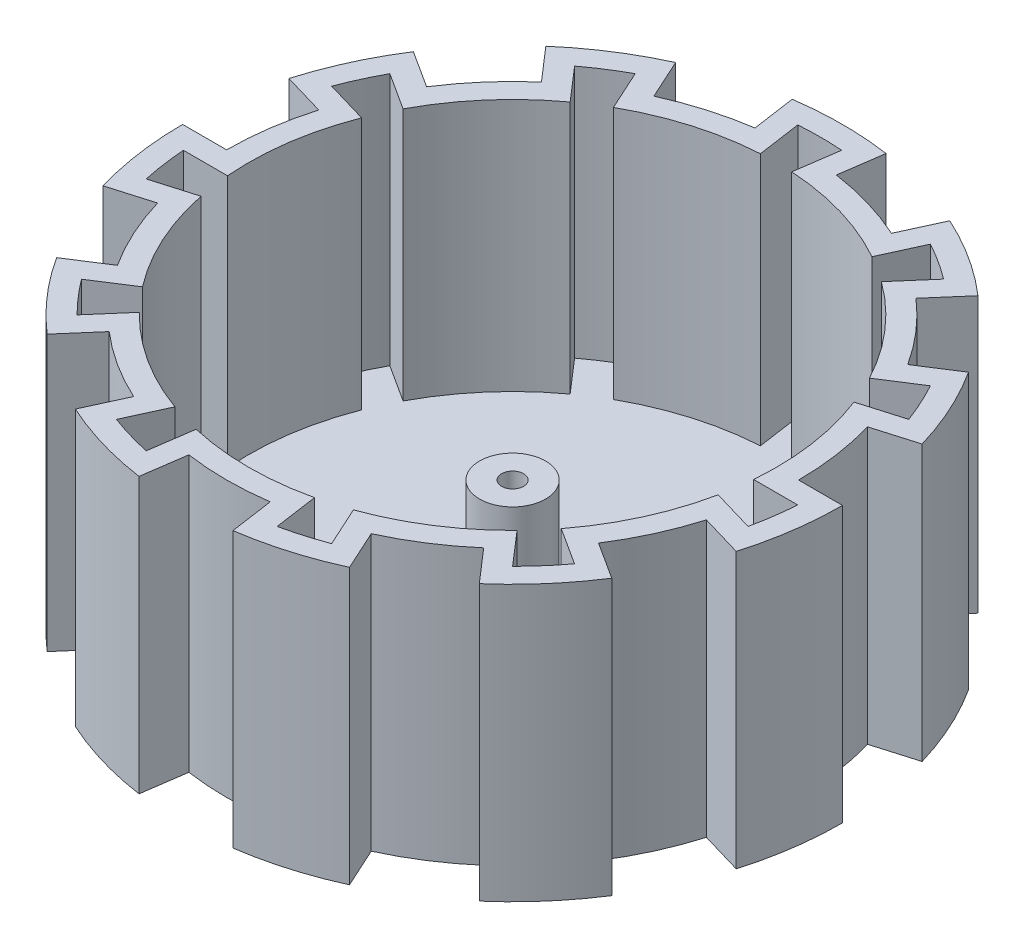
SolidWorks part; units mm, degrees
ref_plane "Front Plane" through (0, 0, 0) normal (0, 0, 1) x (1, 0, 0)
ref_plane "Top Plane" through (0, 0, 0) normal (0, 1, 0) x (1, 0, 0)
ref_plane "Right Plane" through (0, 0, 0) normal (1, 0, 0) x (0, 0, -1)
sketch "Sketch1" plane through (0, 0, 0) normal (0, 1, 0) x (1, 0, 0)
  line L0 (-38.1, 0) -> (-33.02, 0)
  line L1 (-32.0518, 20.5984) -> (-27.7782, 17.852)
  line L2 (-15.8273, 34.657) -> (-13.717, 30.036)
  line L3 (5.4222, 37.7122) -> (4.6992, 32.6839)
  line L4 (24.9502, 28.7941) -> (21.6235, 24.9549)
  line L5 (36.5567, 10.734) -> (31.6825, 9.3028)
  line L6 (36.5567, -10.734) -> (31.6825, -9.3028)
  line L7 (24.9502, -28.7941) -> (21.6235, -24.9549)
  line L8 (5.4222, -37.7122) -> (4.6992, -32.6839)
  line L9 (-15.8273, -34.657) -> (-13.717, -30.036)
  line L10 (-32.0518, -20.5984) -> (-27.7782, -17.852)
  line L11 (-31.6825, 9.3028) -> (-36.5567, 10.734)
  line L12 (27.7782, -17.852) -> (32.0518, -20.5984)
  line L13 (-21.6235, 24.9549) -> (-24.9502, 28.7941)
  line L14 (13.717, -30.036) -> (15.8273, -34.657)
  line L15 (-4.6992, 32.6839) -> (-5.4222, 37.7122)
  line L16 (-4.6992, -32.6839) -> (-5.4222, -37.7122)
  line L17 (13.717, 30.036) -> (15.8273, 34.657)
  line L18 (-21.6235, -24.9549) -> (-24.9502, -28.7941)
  line L19 (27.7782, 17.852) -> (32.0518, 20.5984)
  line L20 (-31.6825, -9.3028) -> (-36.5567, -10.734)
  line L21 (33.02, 0) -> (38.1, 0)
  arc A0 (-32.0518, 20.5984) -> (-36.5567, 10.734) centre (0, 0) ccw
  arc A1 (-31.6825, 9.3028) -> (-33.02, 0) centre (0, 0) ccw
  arc A2 (-21.6235, 24.9549) -> (-27.7782, 17.852) centre (0, 0) ccw
  arc A3 (-15.8273, 34.657) -> (-24.9502, 28.7941) centre (0, 0) ccw
  arc A4 (-4.6992, 32.6839) -> (-13.717, 30.036) centre (0, 0) ccw
  arc A5 (5.4222, 37.7122) -> (-5.4222, 37.7122) centre (0, 0) ccw
  arc A6 (13.717, 30.036) -> (4.6992, 32.6839) centre (0, 0) ccw
  arc A7 (24.9502, 28.7941) -> (15.8273, 34.657) centre (0, 0) ccw
  arc A8 (27.7782, 17.852) -> (21.6235, 24.9549) centre (0, 0) ccw
  arc A9 (36.5567, 10.734) -> (32.0518, 20.5984) centre (0, 0) ccw
  arc A10 (33.02, 0) -> (31.6825, 9.3028) centre (0, 0) ccw
  arc A11 (36.5567, -10.734) -> (38.1, 0) centre (0, 0) ccw
  arc A12 (27.7782, -17.852) -> (31.6825, -9.3028) centre (0, 0) ccw
  arc A13 (24.9502, -28.7941) -> (32.0518, -20.5984) centre (0, 0) ccw
  arc A14 (13.717, -30.036) -> (21.6235, -24.9549) centre (0, 0) ccw
  arc A15 (5.4222, -37.7122) -> (15.8273, -34.657) centre (0, 0) ccw
  arc A16 (-4.6992, -32.6839) -> (4.6992, -32.6839) centre (0, 0) ccw
  arc A17 (-15.8273, -34.657) -> (-5.4222, -37.7122) centre (0, 0) ccw
  arc A18 (-21.6235, -24.9549) -> (-13.717, -30.036) centre (0, 0) ccw
  arc A19 (-32.0518, -20.5984) -> (-24.9502, -28.7941) centre (0, 0) ccw
  arc A20 (-31.6825, -9.3028) -> (-27.7782, -17.852) centre (0, 0) ccw
  arc A21 (-38.1, 0) -> (-36.5567, -10.734) centre (0, 0) ccw
  circle A22 centre (0, 0) radius 1.27
  point P29 (0, 0)
  dimension "D1" = 76.2
  dimension "D2" = 5.08
  dimension "D6" = 2.54
  dimension "D4" = 7.9065
  dimension "D5" = 5.0812
  dimension "D3" = 11
extrude "Boss-Extrude1" add sketch "Sketch1" along normal blind 31.75
shell "Shell1" thickness 2.54
sketch "Sketch2" plane through (0, 31.75, 0) normal (0, 1, 0) x (1, 0, 0)
  circle A0 centre (0, 0) radius 3.81 construction
  circle A1 centre (0, 0) radius 3.81
extrude "Cut-Extrude1" cut sketch "Sketch2" against normal blind 16.51
